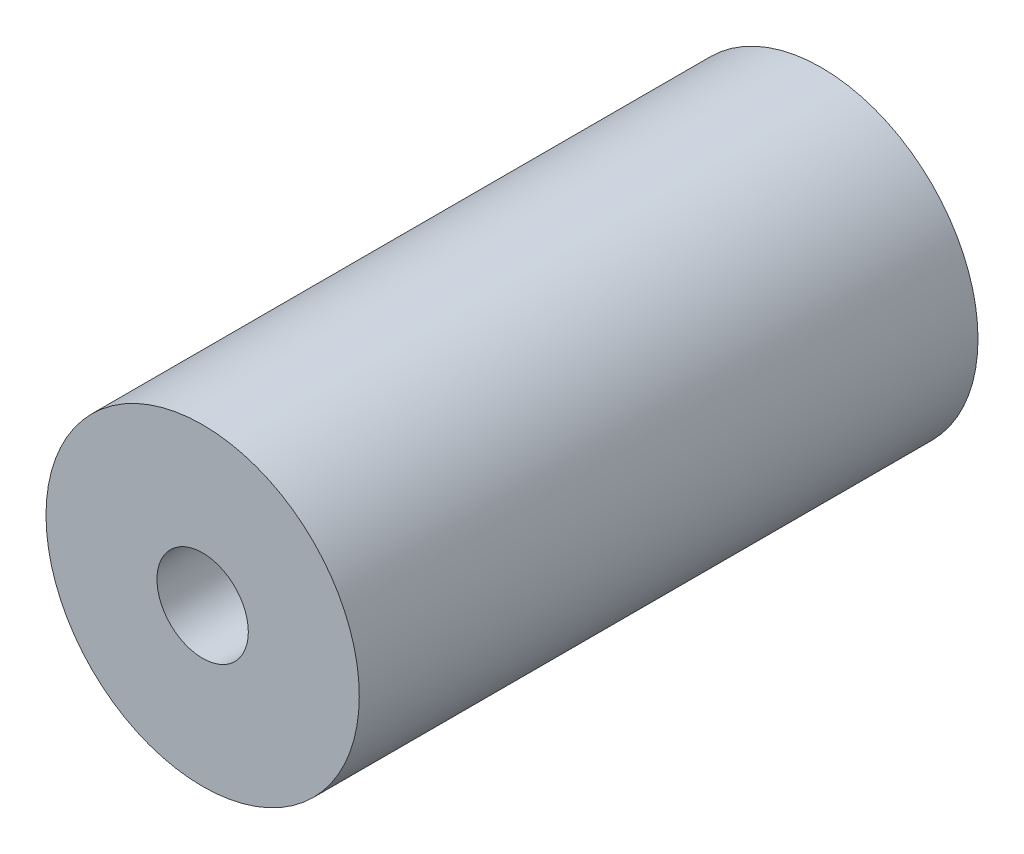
SolidWorks part; units mm, degrees
ref_plane "Plan de face" through (0, 0, 0) normal (0, 0, 1) x (1, 0, 0)
ref_plane "Plan de dessus" through (0, 0, 0) normal (0, 1, 0) x (1, 0, 0)
ref_plane "Plan de droite" through (0, 0, 0) normal (1, 0, 0) x (0, 0, -1)
sketch "Esquisse1" plane through (0, 0, 0) normal (0, 0, 1) x (1, 0, 0)
  circle A0 centre (0, 0) radius 1.75
  circle A1 centre (0, 0) radius 6
  dimension "D1" = 3.5
  dimension "D2" = 12
extrude "Boss.-Extru.1" add sketch "Esquisse1" along normal blind 23.7
